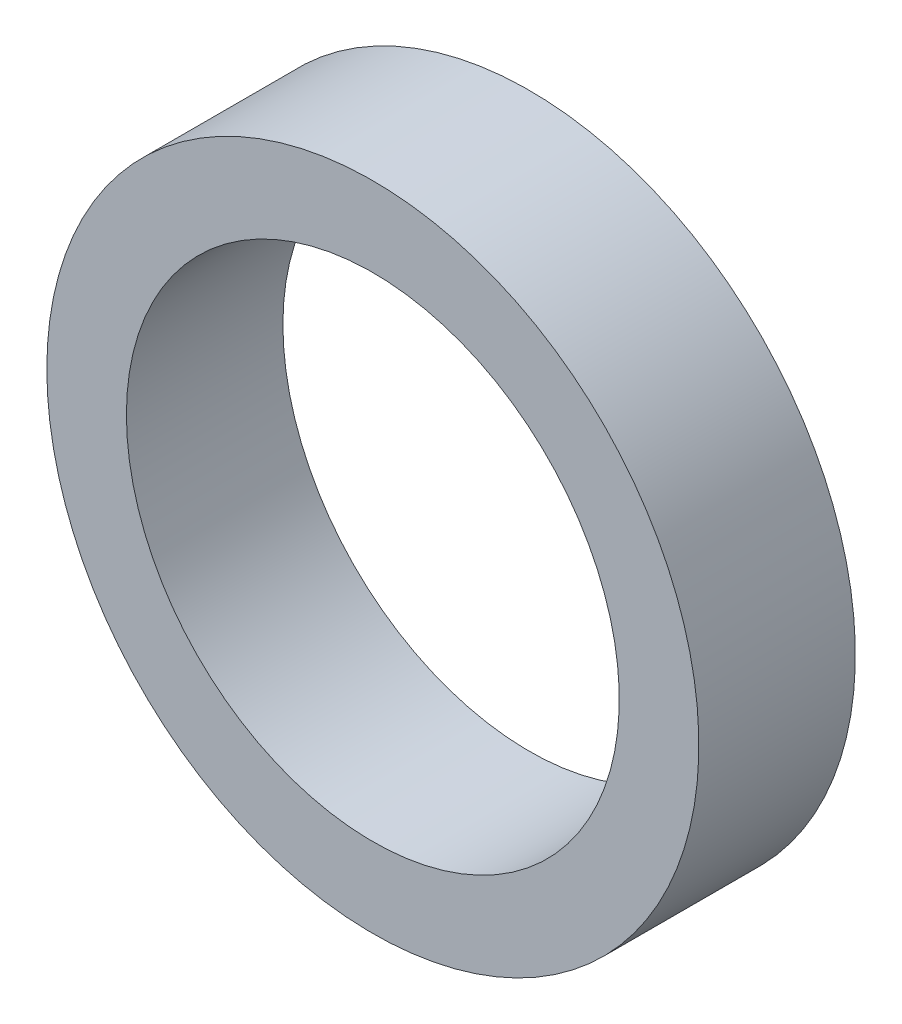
SolidWorks part; units mm, degrees
ref_plane "Front Plane" through (0, 0, 0) normal (0, 0, 1) x (1, 0, 0)
ref_plane "Top Plane" through (0, 0, 0) normal (0, 1, 0) x (1, 0, 0)
ref_plane "Right Plane" through (0, 0, 0) normal (1, 0, 0) x (0, 0, -1)
sketch "Sketch1" plane through (0, 0, 0) normal (0, 0, 1) x (1, 0, 0)
  circle A0 centre (0, 0) radius 6
  circle A1 centre (0, 0) radius 7.9375
  dimension "D1" = 12
  dimension "D2" = 15.875
extrude "Boss-Extrude1" add sketch "Sketch1" along normal blind 3.81
